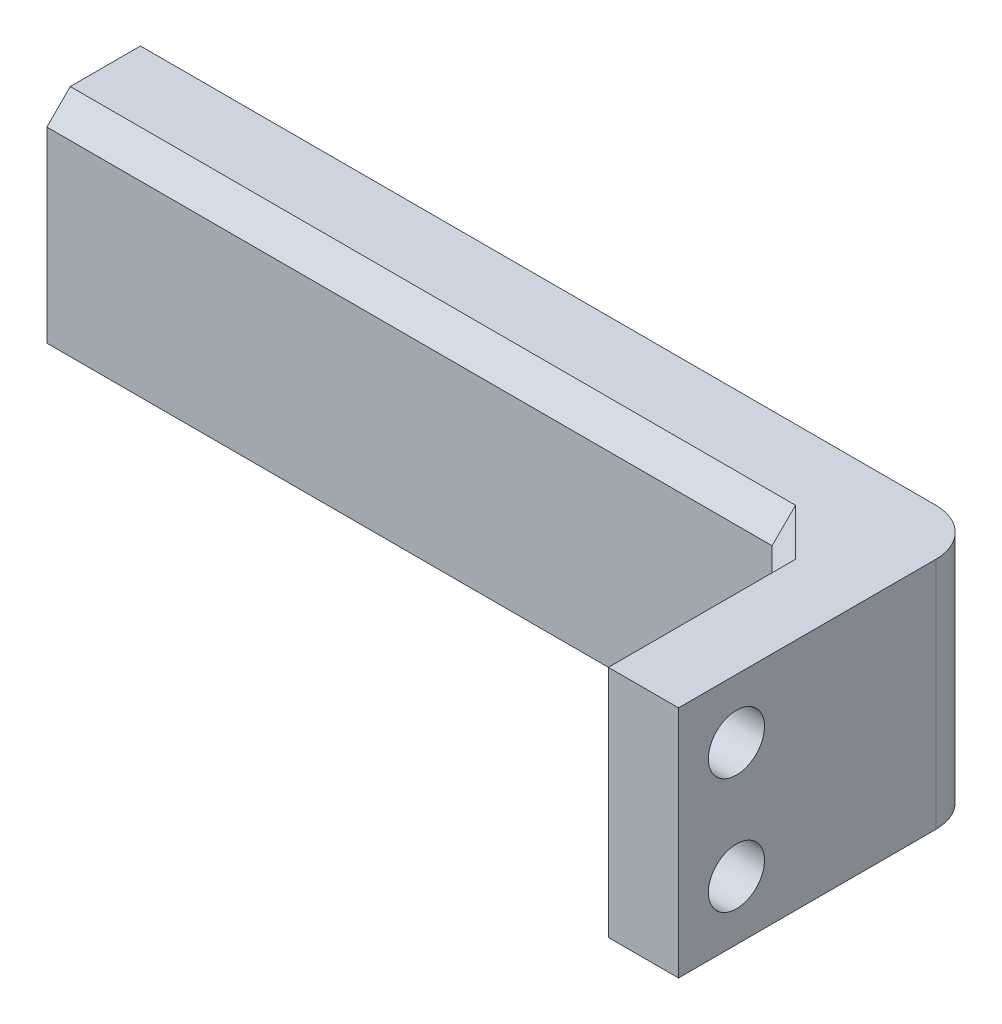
SolidWorks part; units mm, degrees
ref_plane "Plano frontal" through (0, 0, 0) normal (0, 0, 1) x (1, 0, 0)
ref_plane "Plano superior" through (0, 0, 0) normal (0, 1, 0) x (1, 0, 0)
ref_plane "Plano direito" through (0, 0, 0) normal (1, 0, 0) x (0, 0, -1)
sketch "Esboço1" plane through (0, 0, 0) normal (0, 0, 1) x (1, 0, 0)
  line L1 (0, 0) -> (36, 0)
  line L2 (0, 0) -> (0, 14)
  line L3 (0, 14) -> (36, 14)
  line L4 (36, 0) -> (36, 14)
  dimension "D1" = 14
  dimension "D2" = 36
extrude "Ressalto-extrusão1" add sketch "Esboço1" along normal blind 4 contours L2 L3 L4 L1
sketch "Esboço2" plane through (0, 0, 4) normal (0, 0, 1) x (1, 0, 0)
  line L0 (0, 0) -> (36, 0) construction
  line L1 (36, 14) -> (32, 14)
  line L2 (36, 14) -> (36, 0)
  line L3 (36, 0) -> (32, 0)
  line L4 (32, 14) -> (32, 0)
  dimension "D1" = 4
extrude "Ressalto-extrusão2" add sketch "Esboço2" along normal blind 9
sketch "Esboço4" plane through (0, 0, 13) normal (0, 0, 1) x (1, 0, 0)
  line L0 (36, 14) -> (36, 12)
  line L1 (36, 0) -> (36, 14) construction
  line L2 (36, 12) -> (0, 12)
  line L3 (0, 12) -> (0, 14)
  line L4 (0, 14) -> (32, 14) construction
  line L5 (0, 14) -> (36, 14)
  line L6 (36, 0) -> (0, 0)
  line L7 (0, 0) -> (32, 0) construction
  line L8 (0, 0) -> (0, 2)
  line L9 (0, 2) -> (36, 2)
  line L10 (36, 2) -> (36, 0)
  line L11 (0, 0) -> (0, 14) construction
  dimension "D1" = 2
extrude "Corte-extrusão1" cut sketch "Esboço4" against normal through all
sketch "Esboço6" plane through (32, 0, 0) normal (-1, 0, 0) x (0, 0, 1)
  line L0 (13, 12) -> (13, 2) construction
  line L1 (13, 2) -> (13, 12) construction
  line L2 (13, 7) -> (10.5251, 9.4749) construction
  line L3 (13, 7) -> (9.5, 7) construction
  line L4 (13, 7) -> (10.5251, 4.5251) construction
  arc A0 (13, 12) -> (13, 2) centre (13, 7) ccw construction
  arc A1 (13, 10.5) -> (13, 3.5) centre (13, 7) ccw construction
  dimension "D1" = 5
  dimension "D2" = 3.5
  dimension "D3" = 45
  dimension "D4" = 45
hole_wizard "Escareado para parafuso com cabeça escareada chata de M21" positions "3DSketch2" profile "Esboço8" countersink size "M2" standard "ISO"
sketch3d "3DSketch2"
  point P0 (32, 9.4749, 10.5251)
  point P3 (32, 4.5251, 10.5251)
sketch "Esboço8" plane through (32, 9.4749, 10.5251) normal (0, 1, 0) x (0, 0, 1)
  line L0 (0, 0) -> (0, 15.721)
  line L1 (0, 15.721) -> (1.2, 15)
  line L2 (1.2, 15) -> (1.2, 1)
  line L3 (1.2, 1) -> (2.2, 0)
  line L5 (2.2, 0) -> (0, 0)
  line L6 (-1.2, 1) -> (-2.2, 0) construction
  line L10 (0, 15.721) -> (-1.2, 15) construction
  line L11 (0, -6.35) -> (0, 107.95) construction
  dimension "Hole Dia." = 2.4
  dimension "Hole Depth" = 15
  dimension "Near C'Sink Dia." = 4.4
  dimension "Near C'Sink Angle" = 90
  dimension "Drill Angle" = 118
fillet "Filete1" radius 2 1 edges at (36, 7, 0)
chamfer "Chanfro1" distance 1 angle 45 6 edges at (32, 7, 4) (16, 12, 4) (32, 12, 8.5) (32, 7, 13) (32, 2, 8.5) (16, 2, 4)
